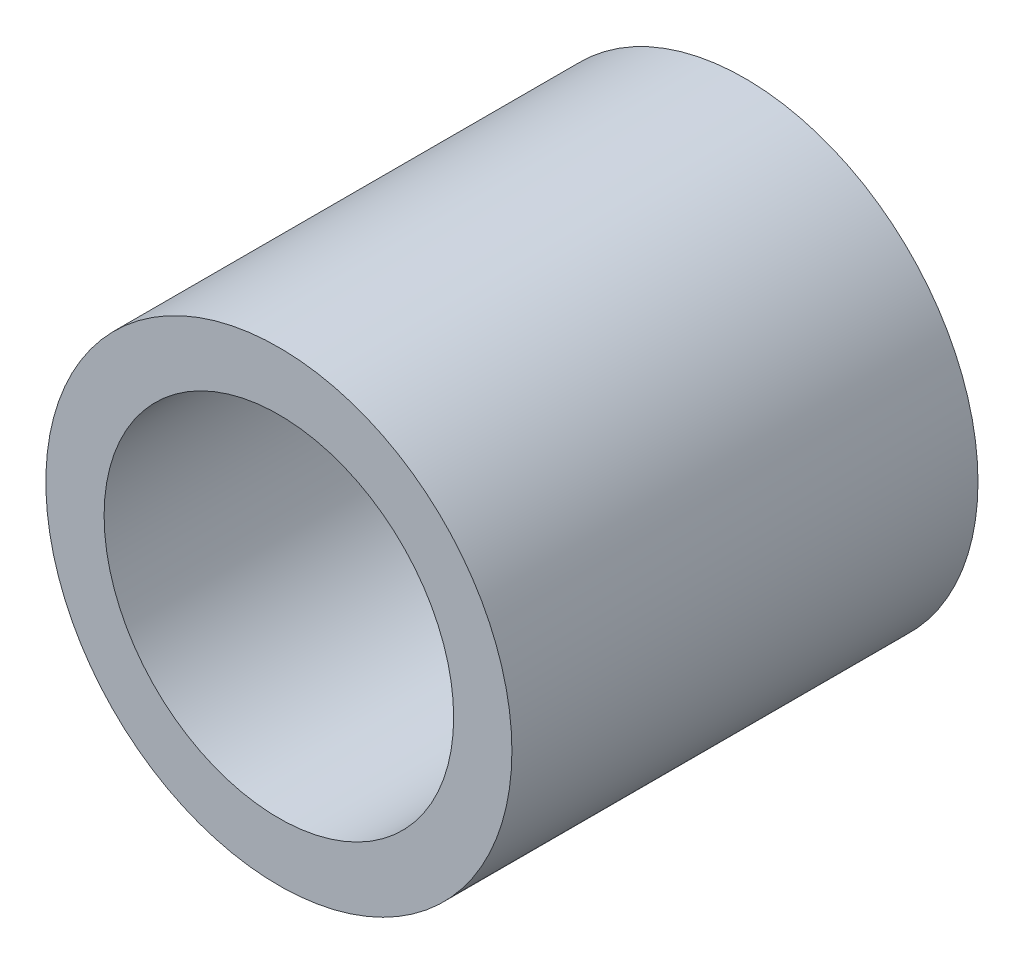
SolidWorks part; units mm, degrees
ref_plane "Plan1" through (0, 0, 0) normal (0, 0, 1) x (1, 0, 0)
ref_plane "Plan2" through (0, 0, 0) normal (0, 1, 0) x (1, 0, 0)
ref_plane "Plan3" through (0, 0, 0) normal (1, 0, 0) x (0, 0, -1)
sketch "Esquisse1" plane through (0, 0, 0) normal (0, 0, 1) x (1, 0, 0)
  circle A0 centre (0, 0) radius 3
  circle A1 centre (0, 0) radius 4
  dimension "D1" = 8
  dimension "D2" = 6
extrude "Base-Extrusion" add sketch "Esquisse1" along normal mid plane 8
